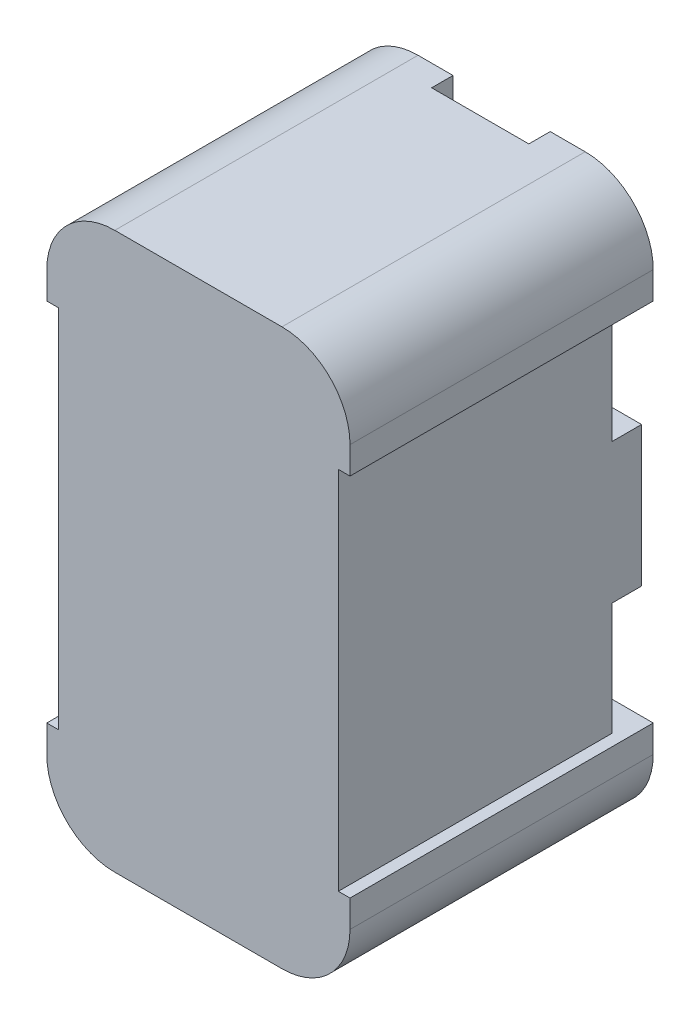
SolidWorks part; units mm, degrees
ref_plane "Front Plane" through (0, 0, 0) normal (0, 0, 1) x (1, 0, 0)
ref_plane "Top Plane" through (0, 0, 0) normal (0, 1, 0) x (1, 0, 0)
ref_plane "Right Plane" through (0, 0, 0) normal (1, 0, 0) x (0, 0, -1)
imported_body "Imported3"
sketch "Sketch1" plane through (67.2, 0, 0) normal (1, 0, 0) x (0, 0, -1)
  line L0 (-4.2, 280.7) -> (-4.2, 285.6)
  line L1 (-4.2, 285.6) -> (11.4, 285.6)
  line L2 (11.4, 285.6) -> (11.4, 280.7)
  line L3 (11.4, 280.7) -> (-4.2, 280.7)
extrude "Extrude1" add sketch "Sketch1" along normal blind 0.6
sketch "Sketch2" plane through (52.8, 0, 0) normal (-1, 0, 0) x (0, 0, 1)
  line L0 (4.2, 285.6) -> (4.2, 280.7)
  line L1 (4.2, 280.7) -> (-11.4, 280.7)
  line L2 (-11.4, 280.7) -> (-11.4, 285.6)
  line L3 (-11.4, 285.6) -> (4.2, 285.6)
extrude "Extrude2" add sketch "Sketch2" along normal blind 0.6
sketch "Sketch3" plane through (52.8, 0, 0) normal (-1, 0, 0) x (0, 0, 1)
  line L0 (4.2, 309.3) -> (4.2, 304.4)
  line L1 (4.2, 304.4) -> (-11.4, 304.4)
  line L2 (-11.4, 304.4) -> (-11.4, 309.3)
  line L3 (-11.4, 309.3) -> (4.2, 309.3)
extrude "Extrude3" add sketch "Sketch3" along normal blind 0.6
sketch "Sketch4" plane through (67.2, 0, 0) normal (1, 0, 0) x (0, 0, -1)
  line L0 (-4.2, 304.4) -> (-4.2, 309.3)
  line L1 (-4.2, 309.3) -> (11.4, 309.3)
  line L2 (11.4, 309.3) -> (11.4, 304.4)
  line L3 (11.4, 304.4) -> (-4.2, 304.4)
extrude "Extrude4" add sketch "Sketch4" along normal blind 0.6
sketch "Sketch5" plane through (0, 280.7, 0) normal (0, -1, 0) x (1, 0, 0)
  line L0 (57.5, -11.4) -> (62.5, -11.4)
  line L1 (62.5, -11.4) -> (62.5, -10.3)
  line L2 (62.5, -10.3) -> (57.5, -10.3)
  line L3 (57.5, -10.3) -> (57.5, -11.4)
extrude "Extrude5" cut sketch "Sketch5" against normal blind 9.8
sketch "Sketch6" plane through (0, 309.3, 0) normal (0, 1, 0) x (-1, 0, 0)
  line L0 (-62.5, -11.4) -> (-57.5, -11.4)
  line L1 (-57.5, -11.4) -> (-57.5, -10.3)
  line L2 (-57.5, -10.3) -> (-62.5, -10.3)
  line L3 (-62.5, -10.3) -> (-62.5, -11.4)
extrude "Extrude6" cut sketch "Sketch6" against normal blind 9.8
sketch "Sketch7" plane through (0, 0, -11.4) normal (0, 0, -1) x (-1, 0, 0)
  line L0 (-65.3, 297.5) -> (-65.3, 292.5)
  line L1 (-65.3, 292.5) -> (-54.7, 292.5)
  line L2 (-54.7, 292.5) -> (-54.7, 297.5)
  line L3 (-54.7, 297.5) -> (-65.3, 297.5)
extrude "Extrude7" cut sketch "Sketch7" against normal blind 0.8
fillet "Fillet1" radius 3.5 1 edges at (52.2, 280.7, -3.6)
fillet "Fillet2" radius 3.5 1 edges at (67.8, 280.7, -3.6)
fillet "Fillet3" radius 3.5 1 edges at (52.2, 309.3, -3.6)
fillet "Fillet4" radius 3.5 1 edges at (67.8, 309.3, -3.6)
